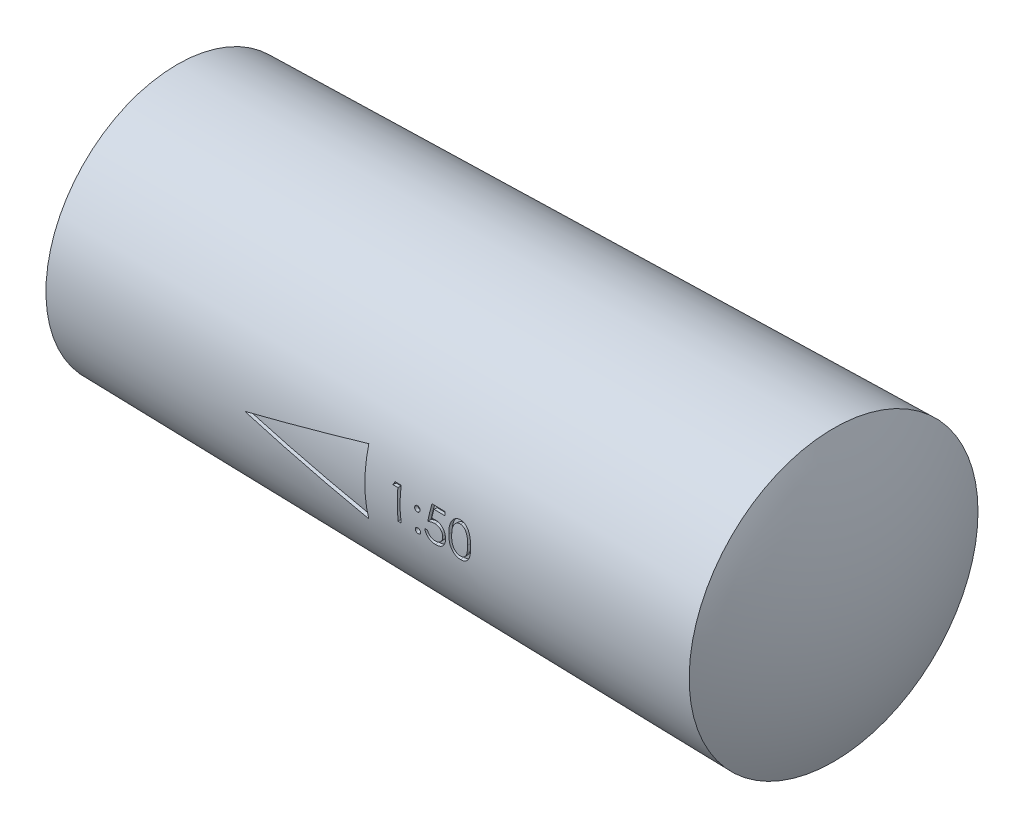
SolidWorks part; units mm, degrees
ref_plane "Front Plane" through (0, 0, 0) normal (0, 0, 1) x (1, 0, 0)
ref_plane "Top Plane" through (0, 0, 0) normal (0, 1, 0) x (1, 0, 0)
ref_plane "Right Plane" through (0, 0, 0) normal (1, 0, 0) x (0, 0, -1)
sketch "Sketch1" plane through (0, 0, 0) normal (1, 0, 0) x (0, 0, -1)
  circle A0 centre (0, 0) radius 4
  dimension "D1" = 8
extrude "Extrude1" add sketch "Sketch1" along normal mid plane 20
draft "Draft1" type of draft neutral plane draft angle 1.146 faces to draft 1 parameters "D1"=1.146
sketch "Sketch2" plane through (0, 0, 0) normal (0, 0, 1) x (1, 0, 0)
  line L0 (-10, 0) -> (-10, 4)
  line L1 (-10, 4) -> (-10, -4) construction
  line L2 (-10, 0) -> (-11, 0)
  line L3 (-11, 0) -> (-11, -4.2) construction
  line L4 (10, 0) -> (10, 4.4)
  line L5 (10, -4.4) -> (10, 4.4) construction
  line L6 (10, 0) -> (11, 0)
  line L7 (11, 0) -> (11, -4.2) construction
  line L8 (-10, -4) -> (10, -4.4) construction
  arc A0 (-11, 0) -> (-10, 4) centre (-2.5, 0) cw
  arc A1 (11, 0) -> (10, 4.4) centre (0.8199, 0) ccw
  point P14 (0, -4.2)
revolve "Revolve1" add sketch "Sketch2" angle 360 about L2
sketch "Sketch5" plane through (0, 0, 0) normal (0, 0, 1) x (1, 0, 0)
  line L0 (0, 4.2) -> (0, -4.2) construction
  line L1 (10, 4.4) -> (-10, 4) construction
  line L2 (-10, -4) -> (10, -4.4) construction
ref_plane "Plane2" through (0, 0, 0) normal (-0.02, 0, 0.9998) x (0.9998, 0, 0.02)
sketch "Sketch6" plane through (0, 0, 0) normal (-0.02, 0, 0.9998) x (0.9998, 0, 0.02)
  line L0 (0, 0) -> (0, 1)
  line L1 (0, 4.2) -> (0, -4.2) construction
  line L2 (0, 1) -> (-3.7321, 0)
  line L3 (-3.7321, 0) -> (0, -1)
  line L4 (0, -1) -> (0, 0)
  line L5 (0, -0.5) -> (4, -0.5) construction
  text T0 "1:50" font "Century Gothic" height 1
  dimension "D1" = 2
  dimension "D2" = 30
  dimension "D3" = 4
wrap "Wrap2" sketch "Sketch6" wrap type deboss source sketch "Sketch6" thickness 0.1 parameters "D1"=0.1
equation "\"D2@Sketch2\" = \"D1@Sketch2\""
